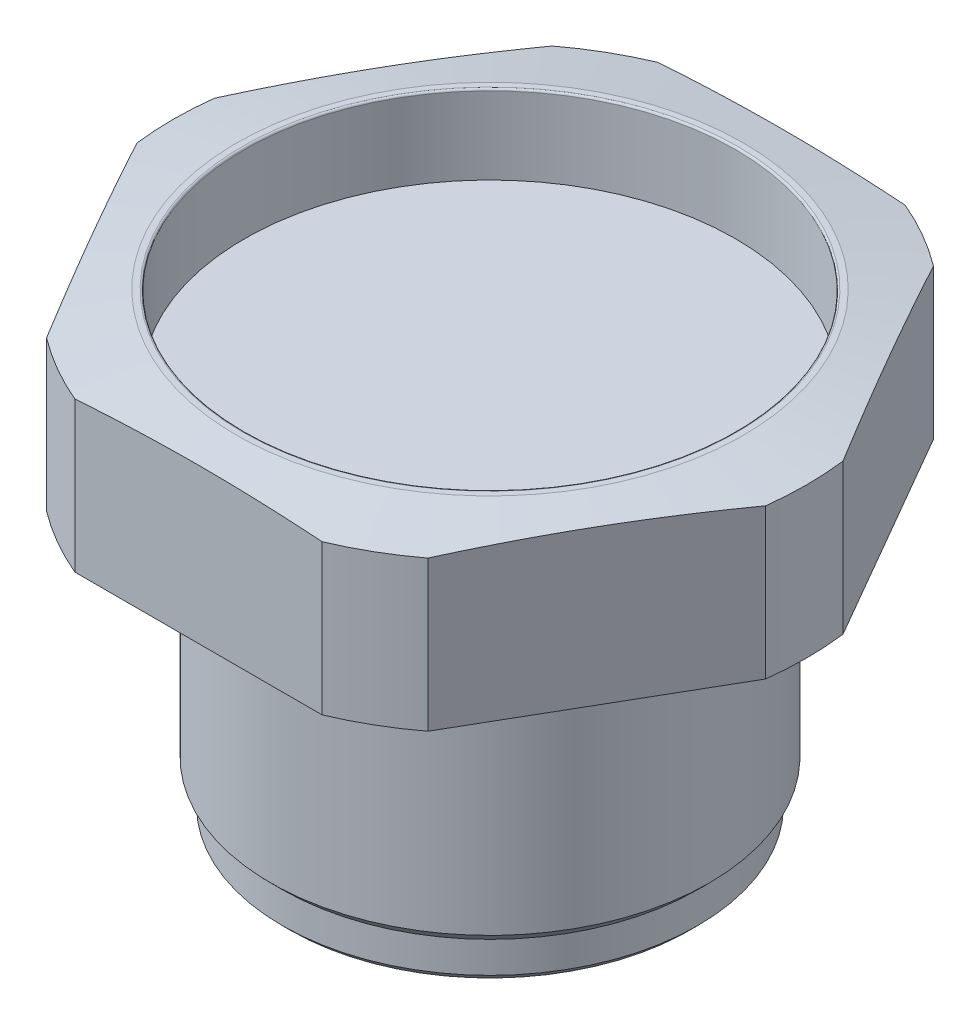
SolidWorks part; units mm, degrees
ref_plane "Front Plane" through (0, 0, 0) normal (0, 0, 1) x (1, 0, 0)
ref_plane "Top Plane" through (0, 0, 0) normal (0, 1, 0) x (1, 0, 0)
ref_plane "Right Plane" through (0, 0, 0) normal (1, 0, 0) x (0, 0, -1)
sketch "Sketch6" plane through (0, 0, 0) normal (0, 0, 1) x (1, 0, 0)
  line L0 (0, -8.9689) -> (0, 71.3762) construction
  line L1 (32.004, 21.0058) -> (33.02, 21.0058)
  line L2 (33.02, 21.0058) -> (41.275, 19.5502)
  line L3 (41.275, 19.5502) -> (41.275, 0)
  line L4 (41.275, 0) -> (27.05, 0)
  line L5 (27.05, 0) -> (27.05, -38.354)
  line L6 (27.05, -38.354) -> (0, -38.354)
  line L7 (0, -38.354) -> (0, 10.6959)
  line L8 (32.004, 21.0058) -> (32.004, 10.6959)
  line L9 (32.004, 10.6959) -> (0, 10.6959)
  dimension "D1" = 54.1
  dimension "D2" = 21.0058
  dimension "D3" = 38.354
  dimension "D4" = 82.55
  dimension "D5" = 10
  dimension "D6" = 66.04
  dimension "D7" = 10.3099
  dimension "D8" = 64.008
  dimension "D9" = 59.3598
revolve "Revolve3" add sketch "Sketch6" angle 360 about L0
fillet "Fillet7" radius 0.25 1 edges at (0, 21.0058, -32.004)
sketch "Sketch7" plane through (0, 0, 0) normal (0, -1, 0) x (1, 0, 0)
  line L0 (0, 0) -> (0, -52.3237) construction
  line L1 (-21.9384, 37.9984) -> (21.9384, 37.9984)
  line L2 (21.9384, 37.9984) -> (43.8768, 0)
  line L3 (43.8768, 0) -> (21.9384, -37.9984)
  line L4 (21.9384, -37.9984) -> (-21.9384, -37.9984)
  line L5 (-21.9384, -37.9984) -> (-43.8768, 0)
  line L6 (-43.8768, 0) -> (-21.9384, 37.9984)
  circle A0 centre (0, 0) radius 43.8768 construction
  dimension "D1" = 75.9968
extrude "Cut-Extrude5" cut sketch "Sketch7" against normal through all flip side to cut
chamfer "Chamfer2" distance 1.016 angle 45 1 edges at (0, -38.354, -27.05)
sketch "Sketch8" plane through (0, 0, 0) normal (0, 0, 1) x (1, 0, 0)
  line L0 (-27.05, -5.08) -> (-27.05, -33.274)
  line L1 (-27.05, 0) -> (-27.05, -37.338) construction
  line L2 (-27.05, -33.274) -> (-28.575, -31.749)
  line L3 (-28.575, -31.749) -> (-28.575, -6.605)
  line L4 (-28.575, -6.605) -> (-27.05, -5.08)
  line L5 (0, 0) -> (0, -37.338) construction
  line L6 (-27.05, -37.338) -> (27.05, -37.338) construction
  line L7 (-26.034, -38.354) -> (26.034, -38.354) construction
  line L9 (-24.8492, 0) -> (-40.9659, 0) construction
  dimension "D1" = 45
  dimension "D2" = 57.15
  dimension "D3" = 5.08
  dimension "D4" = 5.08
revolve "Revolve4" add sketch "Sketch8" angle 360 about L5
fillet "Fillet8" radius 0.508 1 edges at (0, 0, -27.05)
sketch "Sketch9" plane through (0, 0, 0) normal (0, 0, 1) x (1, 0, 0)
  line L0 (0, 0) -> (0, -38.354) construction
  line L1 (-26.034, -38.354) -> (26.034, -38.354) construction
  line L2 (0, -38.354) -> (0, -36.9824)
  line L3 (0, -36.9824) -> (11.2649, -36.9824)
  line L4 (11.2649, -36.9824) -> (11.2649, -38.354)
  line L5 (11.2649, -38.354) -> (0, -38.354)
  line L6 (12.573, -38.354) -> (12.573, -37.8714)
  line L7 (12.7154, -38.354) -> (12.573, -38.354)
  line L8 (14.351, -37.8714) -> (14.351, -38.354)
  line L9 (14.351, -38.354) -> (14.2086, -38.354)
  line L10 (17.2466, -36.9824) -> (22.9743, -36.9824)
  line L12 (22.2277, -38.354) -> (15.875, -38.354)
  arc A0 (17.2466, -36.9824) -> (15.875, -38.354) centre (17.2466, -38.354) ccw
  arc A1 (22.9743, -36.9824) -> (22.2277, -38.354) centre (22.9743, -37.8714) ccw
  arc A2 (12.573, -37.8714) -> (12.7154, -38.354) centre (13.462, -37.8714) ccw
  arc A3 (14.2086, -38.354) -> (14.351, -37.8714) centre (13.462, -37.8714) ccw
  point P14 (17.2466, -36.9824)
  dimension "D2" = 1.778
  dimension "D1" = 0.4826
  dimension "D3" = 45.9486
  dimension "D4" = 31.75
  dimension "D5" = 22.5298
  dimension "D6" = 26.924
revolve "Cut-Revolve1" cut sketch "Sketch9" angle 360 about L0
sketch "Sketch10" plane through (0, 0, 0) normal (0, 0, 1) x (1, 0, 0)
  line L0 (-23.857, -37.7656) -> (-22.0916, -37.7657)
  line L2 (-14.3448, -37.7662) -> (-12.5792, -37.7663)
  line L3 (0, 0) -> (0, -34.798) construction
  arc A0 (-22.2277, -38.354) -> (-22.9743, -36.9824) centre (-22.9743, -37.8714) ccw construction
  arc A1 (-23.857, -37.7656) -> (-22.0916, -37.7657) centre (-22.9743, -37.8714) ccw
  arc A2 (-14.351, -37.8714) -> (-14.2086, -38.354) centre (-13.462, -37.8714) ccw construction
  arc A5 (-14.3448, -37.7662) -> (-12.5792, -37.7663) centre (-13.462, -37.8714) ccw
revolve "Revolve6" add sketch "Sketch10" angle 360 about L3
fillet "Fillet9" radius 0.127 2 edges at (-12.573, -37.8714, 0) (-14.351, -38.354, 0)
